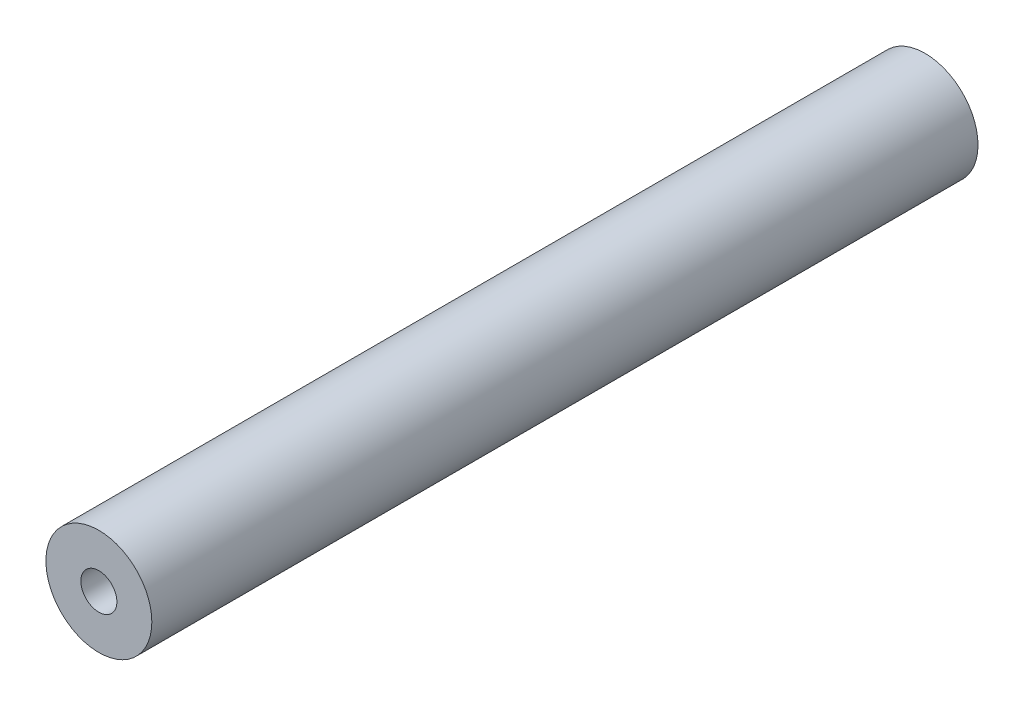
SolidWorks part; units mm, degrees
ref_plane "Face" through (0, 0, 0) normal (0, 0, 1) x (1, 0, 0)
ref_plane "Dessus" through (0, 0, 0) normal (0, 1, 0) x (1, 0, 0)
ref_plane "Droite" through (0, 0, 0) normal (1, 0, 0) x (0, 0, -1)
sketch "Esquisse1" plane through (0, 0, 0) normal (0, 0, 1) x (1, 0, 0)
  circle A0 centre (0, 0) radius 12.5
  dimension "D1" = 25
extrude "Base-Extrusion" add sketch "Esquisse1" along normal blind 195
sketch "Esquisse2" plane through (0, 0, 195) normal (0, 0, 1) x (1, 0, 0)
  circle A0 centre (0, 0) radius 4.25
  dimension "D1" = 8.5
extrude "Enlèv. mat.-Extru.1" cut sketch "Esquisse2" against normal blind 20
sketch "Esquisse3" plane through (0, 0, 0) normal (0, 0, -1) x (-1, 0, 0)
  circle A0 centre (0, 0) radius 4.25
  circle A1 centre (0, 0) radius 4.25 construction
extrude "Enlèv. mat.-Extru.3" cut sketch "Esquisse3" against normal blind 20
